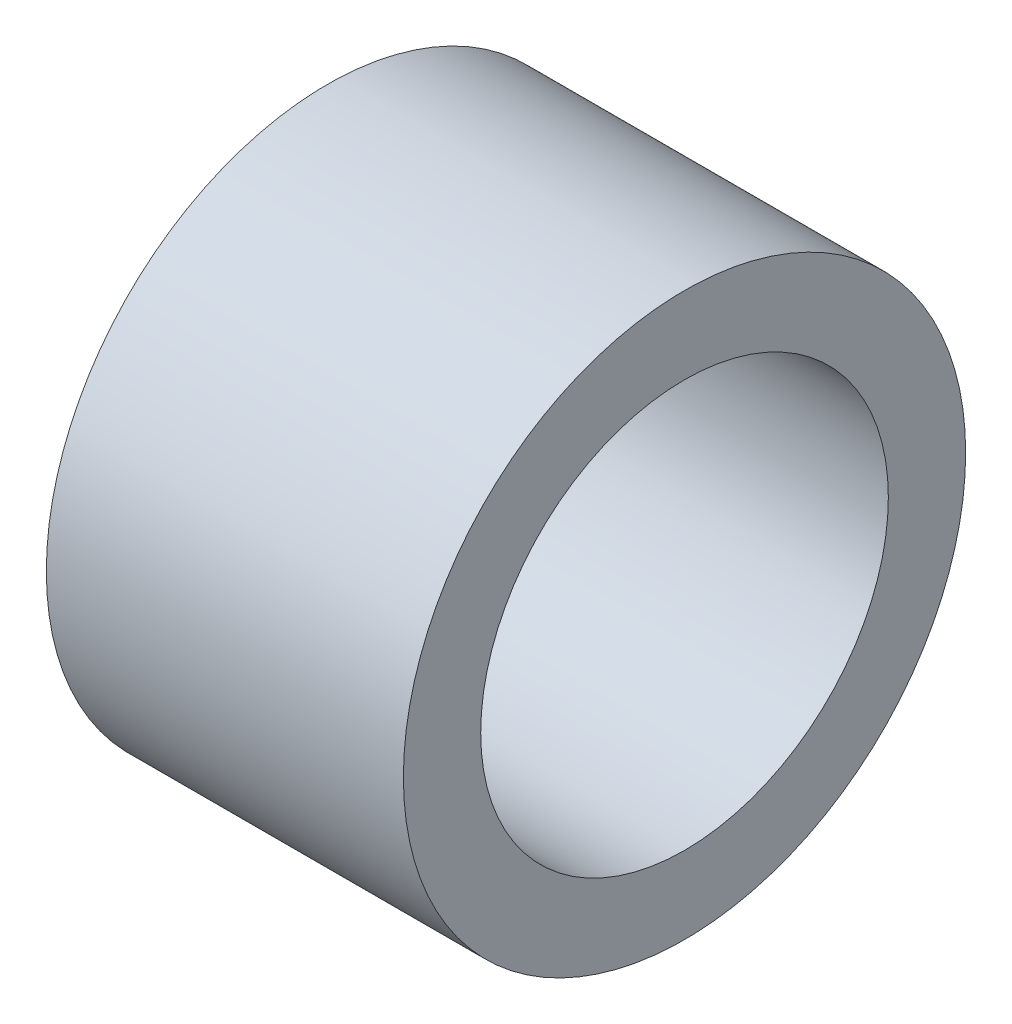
SolidWorks part; units mm, degrees
ref_plane "Front Plane" through (0, 0, 0) normal (0, 0, 1) x (1, 0, 0)
ref_plane "Top Plane" through (0, 0, 0) normal (0, 1, 0) x (1, 0, 0)
ref_plane "Right Plane" through (0, 0, 0) normal (1, 0, 0) x (0, 0, -1)
sketch "Sketch1" plane through (0, 0, 0) normal (1, 0, 0) x (0, 0, -1)
  circle A0 centre (0, 0) radius 1.45
  circle A1 centre (0, 0) radius 2
  dimension "D1" = 2.9
  dimension "D2" = 4
extrude "Boss-Extrude1" add sketch "Sketch1" along normal blind 2.54
